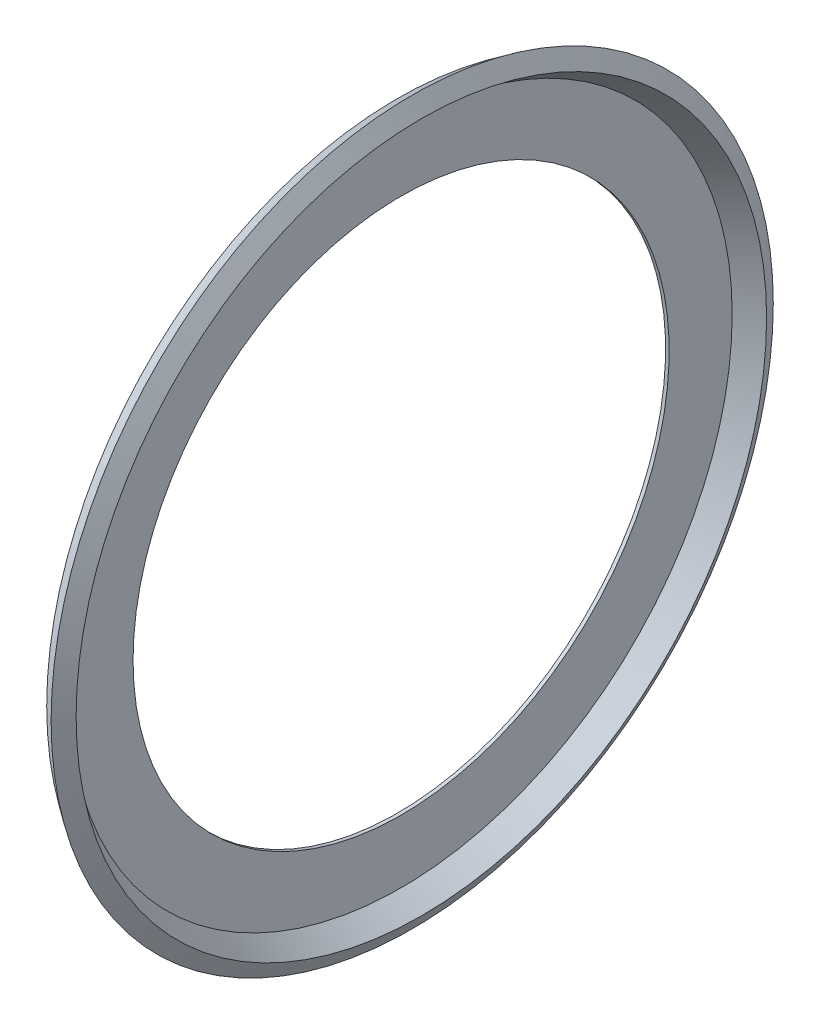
SolidWorks part; units mm, degrees
ref_plane "Face" through (0, 0, 0) normal (0, 0, 1) x (1, 0, 0)
ref_plane "Dessus" through (0, 0, 0) normal (0, 1, 0) x (1, 0, 0)
ref_plane "Droite" through (0, 0, 0) normal (1, 0, 0) x (0, 0, -1)
sketch "Esquisse1" plane through (0, 0, 0) normal (0, 0, 1) x (1, 0, 0)
  line L0 (0, 14.729) -> (0, 11.254)
  line L1 (0, 11.254) -> (0.15, 11.254)
  line L2 (0.15, 11.254) -> (0.15, 13.8988)
  line L3 (0.15, 13.8988) -> (1, 14.494)
  line L4 (1, 14.494) -> (0.6155, 15.16)
  line L5 (0.6155, 15.16) -> (0, 14.729)
  line L6 (1, 0) -> (0, 0) construction
revolve "Révolution1" add sketch "Esquisse1" angle 360 about L6
